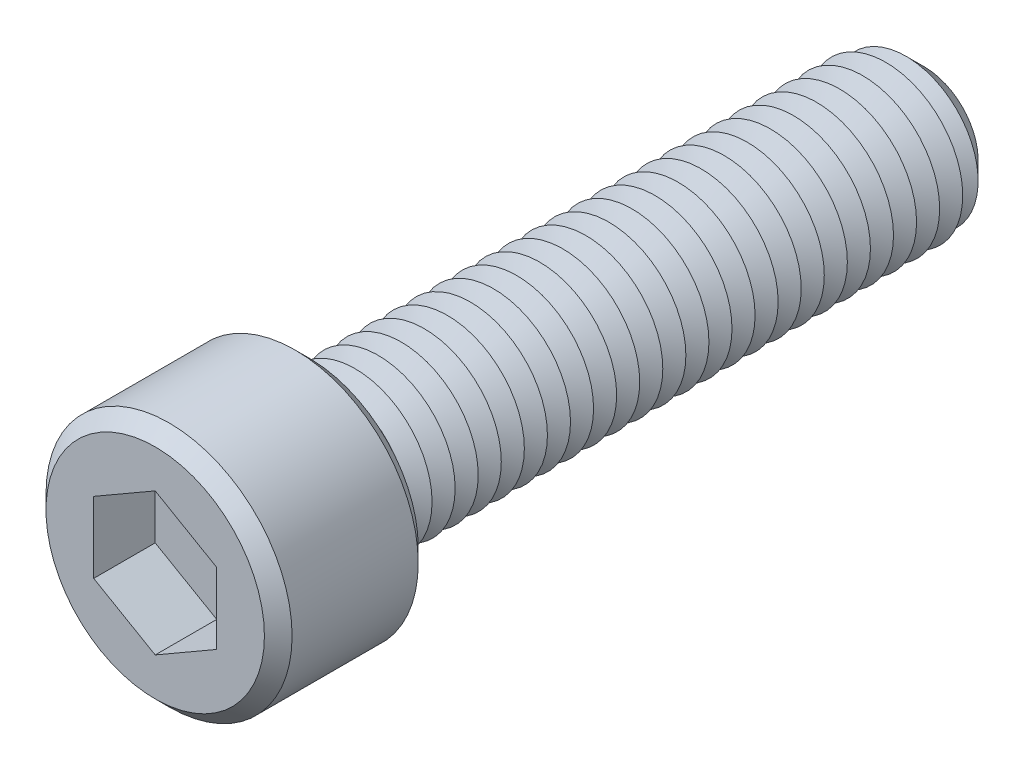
SolidWorks part; units mm, degrees
ref_plane "Front Plane" through (0, 0, 0) normal (0, 0, 1) x (1, 0, 0)
ref_plane "Top Plane" through (0, 0, 0) normal (0, 1, 0) x (1, 0, 0)
ref_plane "Right Plane" through (0, 0, 0) normal (1, 0, 0) x (0, 0, -1)
sketch "Sketch1" plane through (0, 0, 0) normal (0, 0, 1) x (1, 0, 0)
  circle A0 centre (0, 0) radius 8
  dimension "D1" = 16
extrude "Boss-Extrude1" add sketch "Sketch1" along normal blind 10
sketch "Sketch2" plane through (0, 0, 0) normal (0, 0, -1) x (-1, 0, 0)
  circle A0 centre (0, 0) radius 5
  dimension "D1" = 10
extrude "Boss-Extrude2" add sketch "Sketch2" along normal blind 40
chamfer "Chamfer1" distance 1.5 angle 45 1 edges at (-5, 0, -40)
sketch "Sketch3" plane through (0, 0, 0) normal (1, 0, 0) x (0, 0, -1)
  line L0 (-2.5121, 0) -> (4.5776, 0) construction
sketch "Sketch4" plane through (0, 0, 0) normal (1, 0, 0) x (0, 0, -1)
  line L0 (0, 5) -> (0.75, 3.701)
  line L1 (0.75, 3.701) -> (1.5, 5)
  line L2 (38.5, 5) -> (0, 5) construction
  line L3 (1.5, 5) -> (0, 5)
  dimension "D1" = 1.5
revolve "Cut-Revolve1" cut sketch "Sketch4" angle 360 about L0
pattern_linear "LPattern1" count 26 spacing 1.5 along (0, 0, -1) of "Cut-Revolve1"
sketch "Sketch5" plane through (0, 0, 10) normal (0, 0, 1) x (1, 0, 0)
  line L1 (0, 4.6188) -> (-4, 2.3094)
  line L2 (-4, 2.3094) -> (-4, -2.3094)
  line L3 (-4, -2.3094) -> (0, -4.6188)
  line L4 (0, -4.6188) -> (4, -2.3094)
  line L5 (4, -2.3094) -> (4, 2.3094)
  line L6 (4, 2.3094) -> (0, 4.6188)
  circle A0 centre (0, 0) radius 4 construction
  dimension "D1" = 8
extrude "Cut-Extrude1" cut sketch "Sketch5" against normal blind 4
sketch "Sketch6" plane through (0, 0, 6) normal (0, 0, 1) x (1, 0, 0)
  circle A0 centre (0, 0) radius 0.9
  dimension "D1" = 1.8
extrude "Cut-Extrude2" cut sketch "Sketch6" against normal up to surface (46 mm away)
chamfer "Chamfer2" distance 0.9 angle 45 2 edges at (8, 0, 0) (8, 0, 10)
